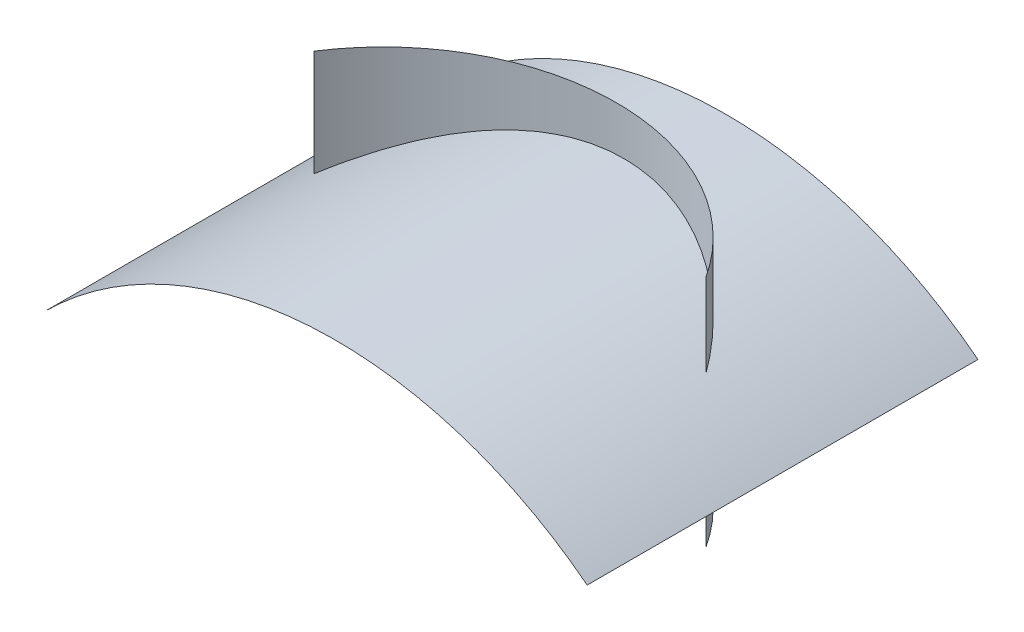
SolidWorks part; units mm, degrees
ref_plane "Front Plane" through (0, 0, 0) normal (0, 0, 1) x (1, 0, 0)
ref_plane "Top Plane" through (0, 0, 0) normal (0, 1, 0) x (1, 0, 0)
ref_plane "Right Plane" through (0, 0, 0) normal (1, 0, 0) x (0, 0, -1)
sketch "Sketch4" plane through (0, 0, 0) normal (0, 1, 0) x (1, 0, 0)
  line L0 (-86.9426, 0) -> (86.9426, 0) construction
  arc A0 (-86.9426, 0) -> (86.9426, 0) centre (0, -56.3559) cw
surface "Surface-Extrude1" sketch "Sketch4" parameters "D1"=103.886
sketch "Sketch5" plane through (0, 0, 0) normal (0, 0, 1) x (1, 0, 0)
  arc A0 (-119.2463, -20.6386) -> (120.989, -6.0082) centre (9.1928, -149.9637) cw
surface "Surface-Extrude2" sketch "Sketch5" parameters "D1"=173.482
sketch3d "3DSketch1"
  spline S0 degree 3 poles (133.7143, 425.245, 880.1197) (-98.8566, -58.5513, 265.2597) (-147.4702, -28.5927, 71.2507) (-76.8456, 10.7479, -13.2641) (-74.008, 12.2415, -16.2735) (-69.4741, 14.4624, -20.5379) (-67.9163, 15.1995, -21.9176) (-65.5074, 16.2958, -23.924) (-64.6924, 16.6598, -24.5823) (-63.0375, 17.3838, -25.8777) (-62.1963, 17.7444, -26.5159) (-57.9484, 19.5274, -29.6369) (-54.4185, 20.8878, -31.9124) (-47.0891, 23.4404, -36.0307) (-43.2896, 24.6327, -37.8735) (-37.3738, 26.2672, -40.302) (-35.3656, 26.7863, -41.0553) (-32.2962, 27.5225, -42.0977) (-31.2635, 27.7608, -42.4306) (-29.1785, 28.2226, -43.0664) (-28.1253, 28.4462, -43.3695) (-22.8555, 29.5161, -44.796) (-18.5922, 30.2264, -45.665) (-9.9702, 31.3461, -46.8649) (-5.6115, 31.7556, -47.1958) (1.0011, 32.1334, -47.2725) (3.2177, 32.2199, -47.228) (6.5621, 32.2886, -47.0519) (7.677, 32.3013, -46.9751) (9.8942, 32.3062, -46.7864) (10.9984, 32.2986, -46.6745) (16.4978, 32.2109, -46.0279) (20.8284, 31.9828, -45.2339) (27.2243, 31.4227, -43.6374) (29.3395, 31.1997, -43.0375) (32.4873, 30.8126, -42.0351) (33.5323, 30.6748, -41.6839) (35.6141, 30.3821, -40.947) (36.6524, 30.2268, -40.5606) (41.7889, 29.4141, -38.5553) (45.739, 28.6453, -36.7123) (53.345, 26.9187, -32.5714) (57.0007, 25.9607, -30.2735) (62.2693, 24.4147, -26.4826) (63.9923, 23.8801, -25.1586) (67.3243, 22.7945, -22.4291) (68.9386, 22.242, -21.02) (73.6324, 20.5654, -16.6613) (76.5633, 19.4223, -13.581) (150.3572, -11.3288, 74.1841) (92.6344, -40.0603, 278.293) (-173.7336, 449.8723, 861.8552) knots -1.534987 -1.534987 -1.534987 -1.534987 0.0625 0.0625 0.125 0.125 0.15625 0.15625 0.171875 0.171875 0.1875 0.1875 0.25 0.25 0.3125 0.3125 0.34375 0.34375 0.359375 0.359375 0.375 0.375 0.4375 0.4375 0.5 0.5 0.53125 0.53125 0.546875 0.546875 0.5625 0.5625 0.625 0.625 0.65625 0.65625 0.671875 0.671875 0.6875 0.6875 0.75 0.75 0.8125 0.8125 0.84375 0.84375 0.875 0.875 0.9375 0.9375 2.55855 2.55855 2.55855 2.55855 only from (-86.9426, 4.8897, 0) to (86.9426, 14.8894, 0)
  spline S1 degree 3 poles (-86.9426, 4.8897, 0) (-84.6444, 6.3164, -3.5455) (-82.1638, 7.7855, -6.9) (-76.8456, 10.7479, -13.2641) (-74.008, 12.2415, -16.2735) (-69.4741, 14.4624, -20.5379) (-67.9163, 15.1995, -21.9176) (-65.5074, 16.2958, -23.924) (-64.6924, 16.6598, -24.5823) (-63.0375, 17.3838, -25.8777) (-62.1963, 17.7444, -26.5159) (-57.9484, 19.5274, -29.6369) (-54.4185, 20.8878, -31.9124) (-47.0891, 23.4404, -36.0307) (-43.2896, 24.6327, -37.8735) (-37.3738, 26.2672, -40.302) (-35.3656, 26.7863, -41.0553) (-32.2962, 27.5225, -42.0977) (-31.2635, 27.7608, -42.4306) (-29.1785, 28.2226, -43.0664) (-28.1253, 28.4462, -43.3695) (-22.8555, 29.5161, -44.796) (-18.5922, 30.2264, -45.665) (-9.9702, 31.3461, -46.8649) (-5.6115, 31.7556, -47.1958) (1.0011, 32.1334, -47.2725) (3.2177, 32.2199, -47.228) (6.5621, 32.2886, -47.0519) (7.677, 32.3013, -46.9751) (9.8942, 32.3062, -46.7864) (10.9984, 32.2986, -46.6745) (16.4978, 32.2109, -46.0279) (20.8284, 31.9828, -45.2339) (27.2243, 31.4227, -43.6374) (29.3395, 31.1997, -43.0375) (32.4873, 30.8126, -42.0351) (33.5323, 30.6748, -41.6839) (35.6141, 30.3821, -40.947) (36.6524, 30.2268, -40.5606) (41.7889, 29.4141, -38.5553) (45.739, 28.6453, -36.7123) (53.345, 26.9187, -32.5714) (57.0007, 25.9607, -30.2735) (62.2693, 24.4147, -26.4826) (63.9923, 23.8801, -25.1586) (67.3243, 22.7945, -22.4291) (68.9386, 22.242, -21.02) (73.6324, 20.5654, -16.6613) (76.5633, 19.4223, -13.581) (82.0424, 17.1391, -7.0646) (84.5905, 15.9988, -3.6287) (86.9426, 14.8894, 0) knots 0 0 0 0 0.0625 0.0625 0.125 0.125 0.15625 0.15625 0.171875 0.171875 0.1875 0.1875 0.25 0.25 0.3125 0.3125 0.34375 0.34375 0.359375 0.359375 0.375 0.375 0.4375 0.4375 0.5 0.5 0.53125 0.53125 0.546875 0.546875 0.5625 0.5625 0.625 0.625 0.65625 0.65625 0.671875 0.671875 0.6875 0.6875 0.75 0.75 0.8125 0.8125 0.84375 0.84375 0.875 0.875 0.9375 0.9375 1 1 1 1
  point P0 (0, 116.2834, -133.0476)
